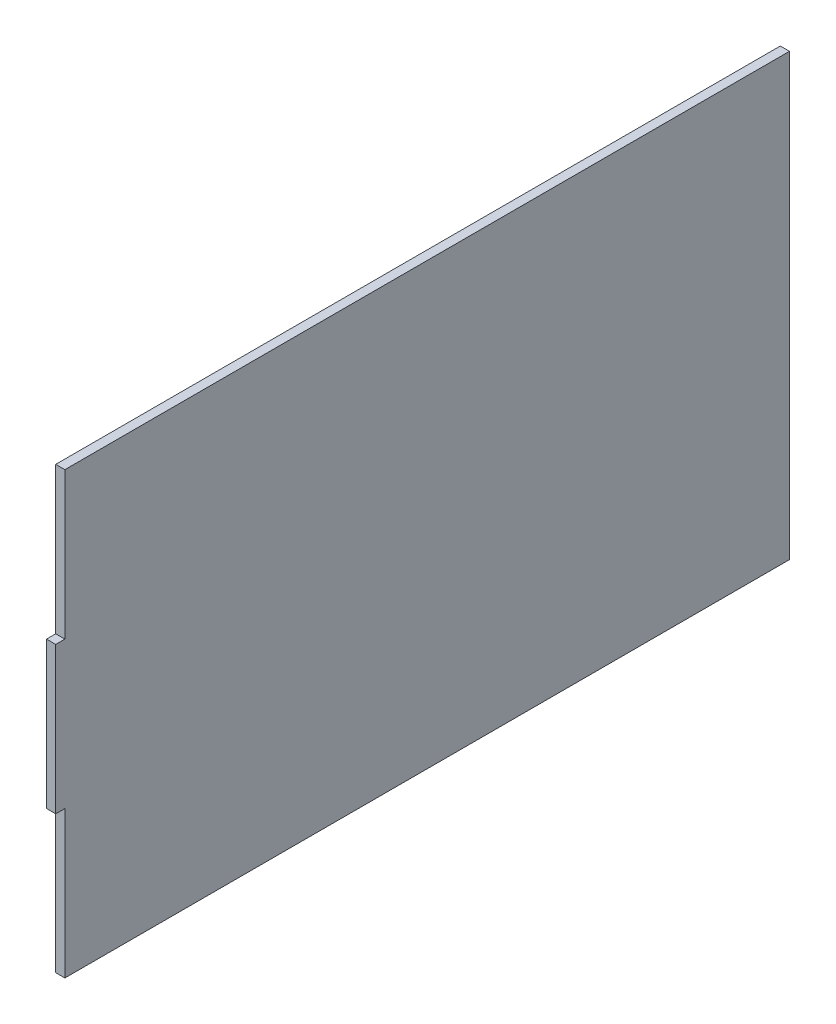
SolidWorks part; units mm, degrees
ref_plane "Front Plane" through (0, 0, 0) normal (0, 0, 1) x (1, 0, 0)
ref_plane "Top Plane" through (0, 0, 0) normal (0, 1, 0) x (1, 0, 0)
ref_plane "Right Plane" through (0, 0, 0) normal (1, 0, 0) x (0, 0, -1)
sketch "Sketch1" plane through (0, 0, 0) normal (0, 1, 0) x (1, 0, 0)
  line L1 (-1.5875, 127) -> (1.5875, 127)
  line L2 (-1.5875, 127) -> (-1.5875, -127)
  line L3 (-1.5875, -127) -> (1.5875, -127)
  line L4 (1.5875, 127) -> (1.5875, -127)
  line L5 (-1.5875, 127) -> (1.5875, -127) construction
  line L6 (-1.5875, -127) -> (1.5875, 127) construction
  point P0 (0, 0)
extrude "Boss-Extrude1" add sketch "Sketch1" along normal blind 152.4
sketch "Sketch2" plane through (-1.5875, 0, 0) normal (-1, 0, 0) x (0, 0, 1)
  line L0 (-127, 50.8) -> (127, 50.8) construction
  line L1 (-127, 152.4) -> (-127, 0) construction
  line L2 (127, 152.4) -> (127, 0) construction
  line L3 (-127, 0) -> (127, 0) construction
  line L4 (-127, 63.5) -> (95.5103, 38.1) construction
  line L5 (-127, 63.5) -> (117.475, 63.5)
  line L6 (-127, 63.5) -> (-127, 38.1)
  line L7 (-127, 38.1) -> (117.475, 38.1)
  line L8 (117.475, 63.5) -> (117.475, 38.1)
  point P8 (0, 50.8)
  point P13 (-127, 50.8)
extrude "Cut-Extrude1" cut sketch "Sketch2" against normal blind 1.5875
sketch "Sketch3" plane through (-1.5875, 0, 0) normal (-1, 0, 0) x (0, 0, 1)
  line L0 (127, 76.2) -> (157.2308, 76.2) construction
  line L1 (127, 152.4) -> (127, 0) construction
  line L7 (127, 50.8) -> (123.825, 50.8)
  line L8 (127, 152.4) -> (123.825, 152.4)
  line L9 (127, 152.4) -> (127, 101.6)
  line L10 (127, 101.6) -> (123.825, 101.6)
  line L11 (123.825, 152.4) -> (123.825, 101.6)
  line L12 (123.825, 0) -> (123.825, 50.8)
  line L13 (127, 0) -> (123.825, 0)
  line L14 (127, 0) -> (127, 50.8)
extrude "Cut-Extrude2" cut sketch "Sketch3" against normal through all
sketch "Sketch4" plane through (1.5875, 0, 0) normal (1, 0, 0) x (0, 0, -1)
  line L0 (127, 50.8) -> (-135.8165, 50.8) construction
  line L1 (127, 152.4) -> (127, 0) construction
  line L2 (-123.825, 0) -> (127, 0) construction
  line L3 (-123.825, 50.8) -> (-123.825, 0) construction
  line L4 (127, 63.5) -> (-103.825, 63.5)
  line L5 (127, 63.5) -> (127, 38.1)
  line L6 (127, 38.1) -> (-103.825, 38.1)
  line L7 (-103.825, 63.5) -> (-103.825, 38.1)
  point P12 (127, 50.8)
extrude "Cut-Extrude3" [suppressed] cut sketch "Sketch4" against normal blind 1.5875
equation "\"RackHeight\" = 2.0in"
equation "\"D1@Sketch2\"=\"RackHeight\""
equation "\"RackThickness\" = 1.0in"
equation "\"D2@Sketch2\"=\"RackThickness\""
equation "\"RackCapLength\" = 20mm"
equation "\"WallThickness\" = 0.125in"
equation "\"WallHeight\" = 6in"
equation "\"D1@Boss-Extrude1\"=\"WallHeight\""
equation "\"D2@Sketch1\"=\"WallThickness\""
equation "\"D1@Sketch1\"= \"SideLength\""
equation "\"D1@Sketch3\"=\"WallThickness\""
equation "\"D2@Sketch3\"=\"WallHeight\"/3"
equation "\"SideLength\" = 10in"
equation "\"BackLength\" = 11.25in"
equation "\"D1@Sketch4\"=\"RackHeight\""
equation "\"D2@Sketch4\"=\"RackCapLength\""
equation "\"D3@Sketch4\"=\"RackThickness\""
equation "\"D1@Cut-Extrude3\"=\"WallThickness\"/2"
equation "\"D1@Cut-Extrude1\"=\"WallThickness\"/2"
equation "\"RackLength\" = 9.5in"
equation "\"HoleDiameter\" = 4.3688mm"
equation "\"D3@Sketch2\"=\"RackLength\"+0.125in"
